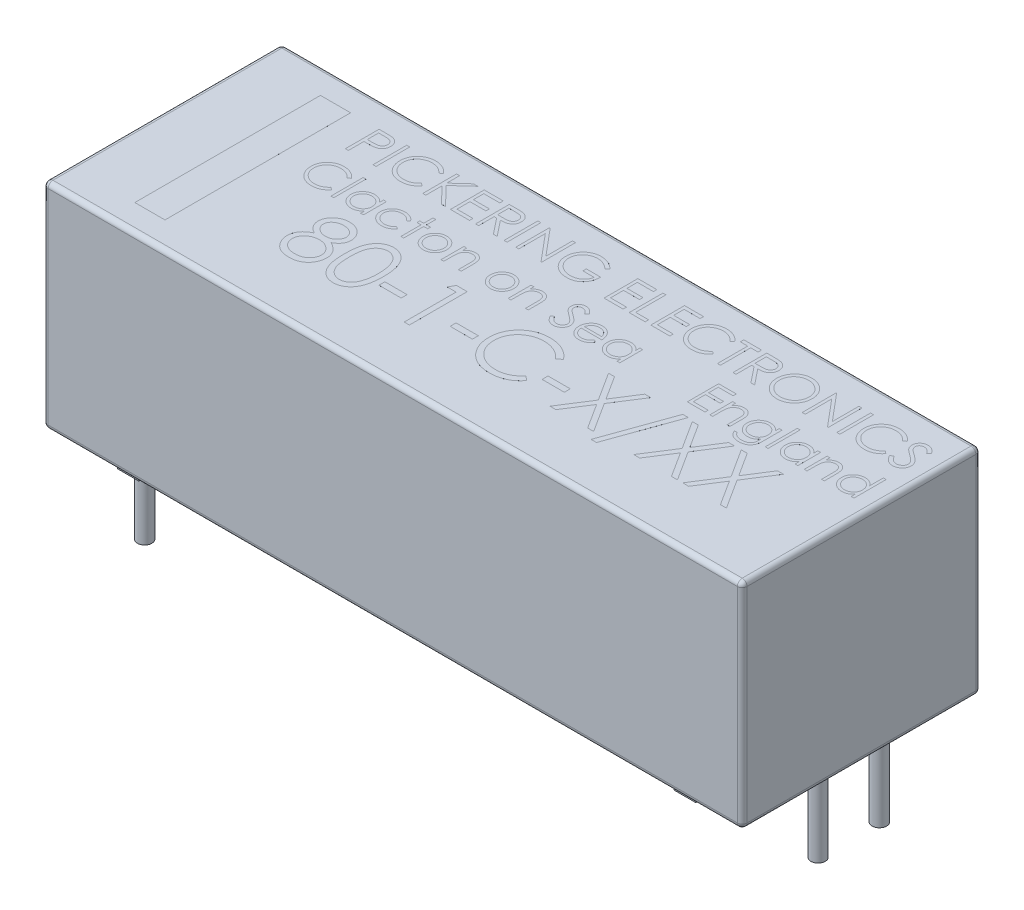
SolidWorks part; units mm, degrees
ref_plane "Front Plane" through (0, 0, 0) normal (0, 0, 1) x (1, 0, 0)
ref_plane "Top Plane" through (0, 0, 0) normal (0, 1, 0) x (1, 0, 0)
ref_plane "Right Plane" through (0, 0, 0) normal (1, 0, 0) x (0, 0, -1)
sketch "Sketch2" plane through (0, 0, 0) normal (0, 1, 0) x (1, 0, 0)
  line L1 (14.5, -4.95) -> (-14.5, -4.95)
  line L2 (14.5, -4.95) -> (14.5, 4.95)
  line L3 (14.5, 4.95) -> (-14.5, 4.95)
  line L4 (-14.5, -4.95) -> (-14.5, 4.95)
  line L5 (14.5, -4.95) -> (-14.5, 4.95) construction
  line L6 (14.5, 4.95) -> (-14.5, -4.95) construction
  point P0 (0, 0)
  dimension "D1" = 9.9
  dimension "D2" = 29
extrude "Main Body" add sketch "Sketch2" along normal blind 8.89 draft 0.023
sketch "Sketch3"
  dimension "D1" = 1.25
  dimension "D2" = 7.7
  dimension "D3" = 1.0965
  dimension "D4" = 2.7
  dimension "D5" = 1.4
  dimension "D6" = 2
extrude "Lettering" add sketch "Sketch3" along normal blind 0.0001
sketch "Sketch4" plane through (0, 0, 0) normal (0, -1, 0) x (1, 0, 0)
  line L0 (-14.5, -4.95) -> (-14.5, 4.95) construction
  line L1 (-12, 4.375) -> (-11.1, 4.375)
  line L2 (-12, 4.375) -> (-12, -4.375)
  line L3 (-12, -4.375) -> (-11.1, -4.375)
  line L4 (-11.1, 4.375) -> (-11.1, -4.375)
  line L5 (-14.5, 4.95) -> (14.5, 4.95) construction
  dimension "D1" = 8.75
  dimension "D2" = 0.9
  dimension "D3" = 2.5
  dimension "D4" = 0.575
extrude "Bobbin feet" add sketch "Sketch4" along normal blind 0.51
sketch "Sketch5" plane through (0, -0.51, 0) normal (0, -1, 0) x (1, 0, 0)
  line L0 (-11.1, -4.375) -> (-11.1, 4.375) construction
  line L1 (-11.1, -2.9375) -> (-12, -2.9375)
  line L2 (-11.1, -2.9375) -> (-11.1, -1.9375)
  line L3 (-11.1, -1.9375) -> (-12, -1.9375)
  line L4 (-12, -2.9375) -> (-12, -1.9375)
  line L5 (-12, 4.375) -> (-12, -4.375) construction
  line L6 (-12, 4.375) -> (-12, -4.375) construction
  line L7 (-12, -0.5) -> (-11.1, -0.5)
  line L8 (-12, -0.5) -> (-12, 0.5)
  line L9 (-12, 0.5) -> (-11.1, 0.5)
  line L10 (-11.1, -0.5) -> (-11.1, 0.5)
  line L11 (-11.1, 1.9375) -> (-12, 1.9375)
  line L12 (-11.1, 1.9375) -> (-11.1, 2.9375)
  line L13 (-11.1, 2.9375) -> (-12, 2.9375)
  line L14 (-12, 1.9375) -> (-12, 2.9375)
  line L15 (-12, -4.375) -> (-11.1, -4.375) construction
  dimension "D1" = 1.4375
  dimension "D2" = 1
  dimension "D3" = 1.4375
  dimension "D4" = 1
  dimension "D5" = 1
  dimension "D6" = 1.4375
extrude "Bobbin feet cut" cut sketch "Sketch5" against normal up to surface (0.51 mm away)
sketch "Sketch8" plane through (0, 0, 0) normal (0, -1, 0) x (1, 0, 0)
  line L0 (-14.5, -4.95) -> (-14.5, 4.95) construction
  line L1 (-12, -4.375) -> (-13.925, -4.375)
  line L2 (-12, -4.375) -> (-12, -2.9375)
  line L3 (-12, -2.9375) -> (-13.925, -2.9375)
  line L4 (-13.925, -4.375) -> (-13.925, -2.9375)
  line L5 (-12, -2.9375) -> (-11.1, -2.9375) construction
  dimension "D1" = 0.575
extrude "Extrude5" add sketch "Sketch8" along normal blind 0.1
pattern_linear "LPattern1" count 4 spacing 2.4385 along (0, 0, 1) of "Extrude5"
mirror "Mirror1" about plane through (0, 0, 0) normal (1, 0, 0) of "Extrude5", "Bobbin feet cut", "Bobbin feet", "LPattern1"
sketch "Sketch9" plane through (0, 0, 0) normal (0, -1, 0) x (1, 0, 0)
  line L0 (14.5, -4.95) -> (-14.5, -4.95) construction
  line L1 (14.5, 4.95) -> (14.5, -4.95) construction
  circle A0 centre (12.7, -2.54) radius 0.3
  circle A1 centre (12.7, 0) radius 0.2963
  dimension "D1" = 0.6
  dimension "D2" = 2.41
  dimension "D3" = 2.54
  dimension "D4" = 1.8
extrude "Pins" add sketch "Sketch9" along normal blind 4.31
mirror "Mirror2" about plane through (0, 0, 0) normal (1, 0, 0) of "Pins"
sketch "Sketch10" plane through (0, 0, 0) normal (0, -1, 0) x (1, 0, 0)
  line L0 (-14.5, 4.95) -> (14.5, 4.95) construction
  line L1 (-14.5, -4.95) -> (-14.5, 4.95) construction
  circle A0 centre (-12.7, 2.54) radius 0.3
  dimension "D1" = 0.6
  dimension "D2" = 2.41
  dimension "D3" = 1.8
extrude "Form c pin" add sketch "Sketch10" along normal blind 4.31
fillet "Fillet1" radius 0.2 12 edges at (-14.4983, 4.445, -4.9483) (-14.4965, 8.89, 0) (-14.4983, 4.445, 4.9483) (-14.5, 0, 0) (14.5, 0, 0) (0, 0, -4.95) (0, 0, 4.95) (14.4983, 4.445, -4.9483) (14.4983, 4.445, 4.9483) (14.4965, 8.89, 0) (0, 8.89, 4.9465) (0, 8.89, -4.9465)
